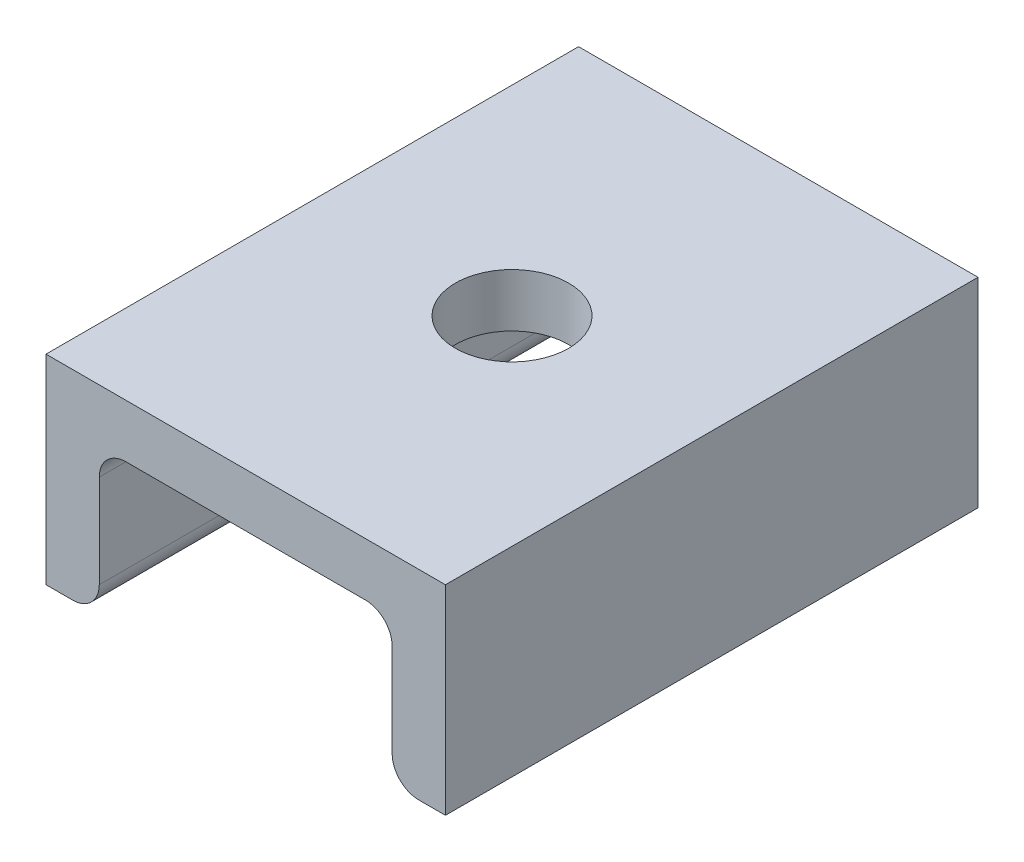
SolidWorks part; units mm, degrees
ref_plane "Plan de face" through (0, 0, 0) normal (0, 0, 1) x (1, 0, 0)
ref_plane "Plan de dessus" through (0, 0, 0) normal (0, 1, 0) x (1, 0, 0)
ref_plane "Plan de droite" through (0, 0, 0) normal (1, 0, 0) x (0, 0, -1)
sketch "Esquisse1" plane through (0, 0, 0) normal (0, 0, 1) x (-1, 0, 0)
  line L0 (-15, 15) -> (-15, 0)
  line L1 (-15, 0) -> (15, 0)
  line L2 (9, 4) -> (-9, 4)
  line L3 (-11, 6) -> (-11, 13)
  line L4 (-13, 15) -> (-15, 15)
  line L5 (0, 10.8286) -> (0, -3.943) construction
  line L6 (13, 15) -> (15, 15)
  line L7 (11, 6) -> (11, 13)
  line L8 (15, 15) -> (15, 0)
  arc A0 (-9, 4) -> (-11, 6) centre (-9, 6) cw
  arc A1 (-11, 13) -> (-13, 15) centre (-13, 13) ccw
  arc A2 (11, 13) -> (13, 15) centre (13, 13) cw
  arc A3 (9, 4) -> (11, 6) centre (9, 6) ccw
  point P20 (0, 4)
  point P21 (0, 0)
  dimension "D5" = 2
  dimension "D2" = 15
  dimension "D3" = 4
  dimension "D4" = 4
  dimension "D6" = 15
extrude "Boss.-Extru.1" add sketch "Esquisse1" along normal blind 40
sketch "Esquisse2" plane through (0, -4, 0) normal (0, -1, 0) x (1, 0, 0)
  line L0 (15, 40) -> (-15, 40) construction
  line L3 (-15, 40) -> (-15, 0) construction
  circle A0 centre (0, 20) radius 4.25
  point P6 (-12.4461, 20.5346)
  point P7 (-12.4303, 18.9181)
  dimension "D1" = 8.5
  dimension "D2" = 20
  dimension "D3" = 15
extrude "Enlèv. mat.-Extru.1" cut sketch "Esquisse2" against normal through all
